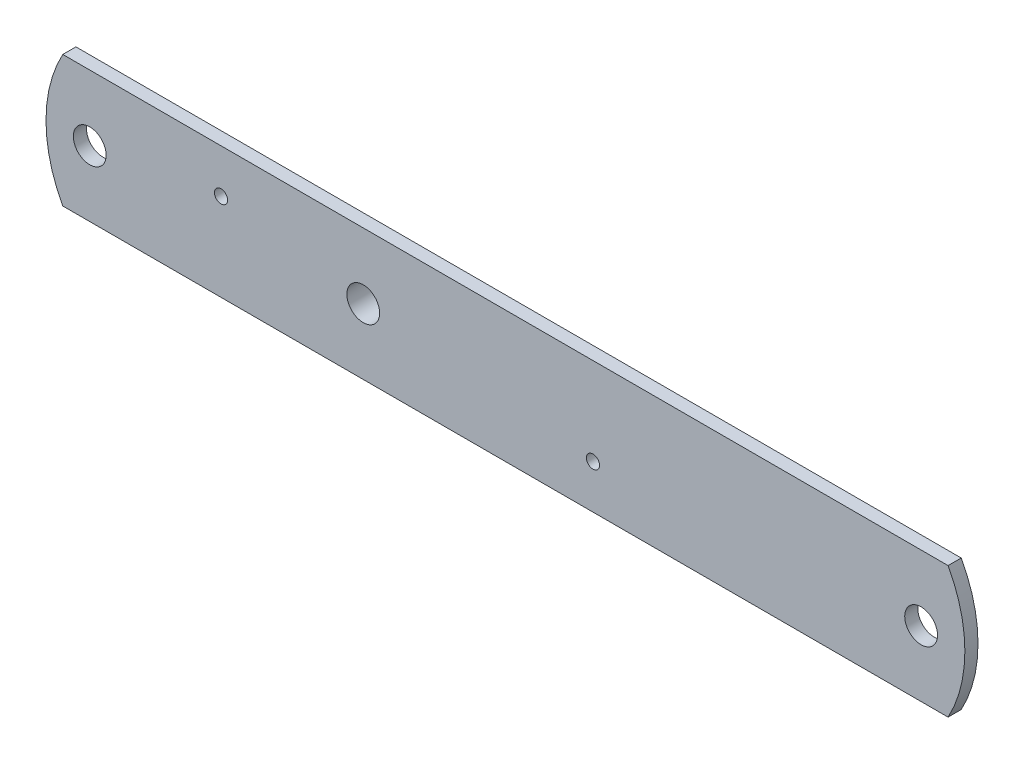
SolidWorks part; units mm, degrees
ref_plane "Plan de face" through (0, 0, 0) normal (0, 0, 1) x (1, 0, 0)
ref_plane "Plan de dessus" through (0, 0, 0) normal (0, 1, 0) x (1, 0, 0)
ref_plane "Plan de droite" through (0, 0, 0) normal (1, 0, 0) x (0, 0, -1)
sketch "Esquisse1" plane through (0, 0, 0) normal (0, 0, 1) x (1, 0, 0)
  line L0 (0, -60) -> (0, 51.89) construction
  line L1 (15.3414, 0) -> (824.6586, 0)
  line L2 (840, -60) -> (840, 141.3895) construction
  line L3 (15.3414, -120) -> (824.6586, -120)
  arc A0 (15.3414, 0) -> (15.3414, -120) centre (125, -60) ccw
  circle A1 centre (40, -60) radius 15
  arc A2 (824.6586, -120) -> (824.6586, 0) centre (715, -60) ccw
  circle A3 centre (160, -40) radius 6
  circle A4 centre (290, -60) radius 15
  circle A5 centre (800, -60) radius 15
  circle A6 centre (500, -80) radius 6
  dimension "D3" = 250
  dimension "D4" = 120
  dimension "D5" = 12
  dimension "D2" = 30
  dimension "D7" = 30
  dimension "D9" = 30
  dimension "D11" = 12
  dimension "D1" = 40
  dimension "D6" = 40
  dimension "D8" = 250
  dimension "D10" = 40
  dimension "D12" = 40
  dimension "D13" = 300
extrude "Extrusion1" add sketch "Esquisse1" along normal blind 12
sketch "Esquisse2" plane through (0, 0, 0) normal (0, 0, -1) x (-1, 0, 0)
  line L0 (-824.6586, 0) -> (-15.3414, 0) construction
  line L1 (-340, -30) -> (-240, -30)
  line L2 (-340, -30) -> (-340, -90)
  line L3 (-340, -90) -> (-240, -90)
  line L4 (-240, -30) -> (-240, -90)
  circle A0 centre (-290, -60) radius 15 construction
  dimension "D4" = 50
  dimension "D1" = 100
  dimension "D2" = 60
  dimension "D3" = 30
extrude "Extrusion2" add sketch "Esquisse2" along normal blind 10
sketch "Esquisse3" plane through (0, 0, -10) normal (0, 0, -1) x (-1, 0, 0)
  circle A0 centre (-290, -60) radius 15
  circle A1 centre (-290, -60) radius 15 construction
  dimension "D1" = 30
extrude "Enlèv. mat.-Extru.1" cut sketch "Esquisse3" against normal through all
